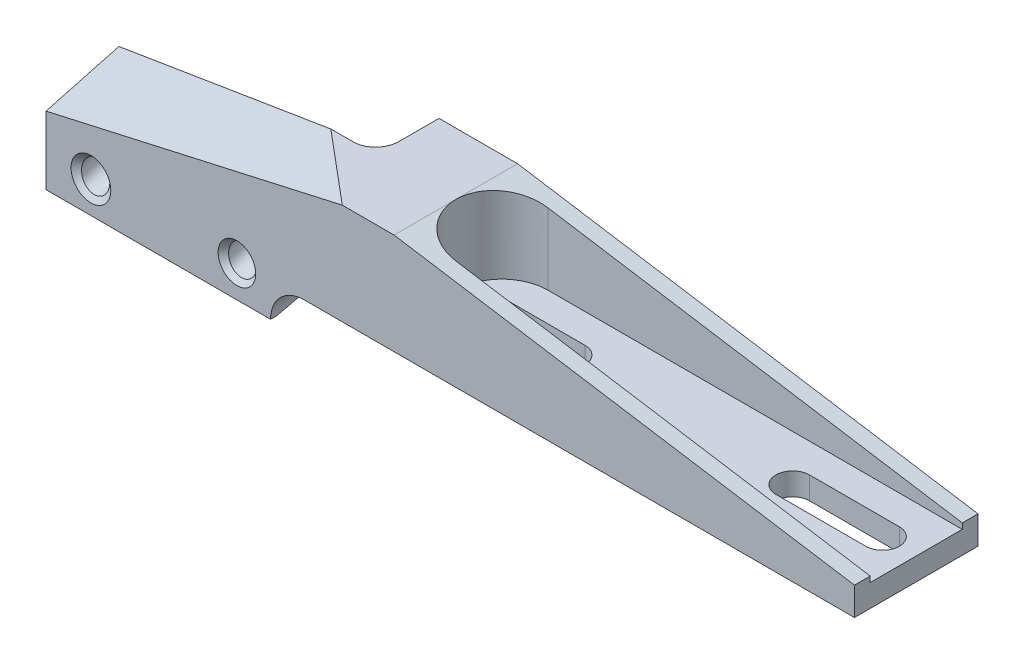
SolidWorks part; units mm, degrees
ref_plane "Front Plane" through (0, 0, 0) normal (0, 0, 1) x (1, 0, 0)
ref_plane "Top Plane" through (0, 0, 0) normal (0, 1, 0) x (1, 0, 0)
ref_plane "Right Plane" through (0, 0, 0) normal (1, 0, 0) x (0, 0, -1)
sketch "Sketch1" plane through (0, 0, 0) normal (0, 0, 1) x (1, 0, 0)
  line L0 (8, 9) -> (-23, 9)
  line L1 (0, 0) -> (49, 0)
  line L2 (-23, 9) -> (-23, -3)
  line L3 (8, 9) -> (49, 2.5)
  line L4 (49, 0) -> (49, 2.5)
  line L5 (-23, -3) -> (-3, -3)
  arc A0 (0, 0) -> (-3, -3) centre (0, -3) ccw
  dimension "D5" = 3
  dimension "D1" = 2.5
  dimension "D2" = 72
  dimension "D3" = 23
  dimension "D4" = 3
  dimension "D6" = 31
  dimension "D7" = 9
extrude "Extrude1" add sketch "Sketch1" along normal blind 18
sketch "Sketch2" plane through (0, 0, 0) normal (0, 1, 0) x (1, 0, 0)
  line L0 (-23, -18) -> (-23, 0) construction
  line L1 (10, -4) -> (18, -4)
  line L2 (10, -4) -> (10, -7) construction
  line L3 (10, -7) -> (18, -7)
  line L4 (18, -4) -> (18, -7) construction
  line L5 (38, -4) -> (46, -4)
  line L6 (38, -4) -> (38, -7) construction
  line L7 (38, -7) -> (46, -7)
  line L8 (46, -4) -> (46, -7) construction
  line L10 (49, -18) -> (-0.75, -18)
  line L11 (49, -18) -> (49, -11)
  line L12 (49, -11) -> (1.5, -11)
  line L13 (-0.75, -18) -> (-0.75, -13.25)
  line L16 (-23, -18) -> (-23, 0) construction
  arc A0 (10, -4) -> (10, -7) centre (10, -5.5) ccw
  arc A1 (18, -7) -> (18, -4) centre (18, -5.5) ccw
  arc A2 (38, -7) -> (38, -4) centre (38, -5.5) cw
  arc A3 (46, -7) -> (46, -4) centre (46, -5.5) ccw
  arc A4 (1.5, -11) -> (-0.75, -13.25) centre (1.5, -13.25) ccw
  dimension "D6" = 2.25
  dimension "D1" = 5.5
  dimension "D2" = 33
  dimension "D3" = 3
  dimension "D4" = 8
  dimension "D5" = 28
  dimension "D7" = 11
  dimension "D8" = 24.5
extrude "Cut-Extrude1" cut sketch "Sketch2" along normal through all and the other way through all
ref_plane "Plane1" through (0, 2, 0) normal (0, 1, 0) x (-1, 0, 0)
sketch "Sketch3" plane through (0, 2, 0) normal (0, 1, 0) x (-1, 0, 0)
  line L0 (-49, 11) -> (-49, 0) construction
  line L1 (-49, 1.4) -> (-12.1, 1.4)
  line L2 (-49, 1.4) -> (-49, 9.6)
  line L3 (-49, 9.6) -> (-12.1, 9.6)
  line L4 (-12.1, 1.4) -> (-12.1, 9.6) construction
  line L5 (-12.1, 5.5) -> (-8, 5.5) construction
  line L6 (23, 18) -> (23, 0) construction
  arc A0 (-12.1, 9.6) -> (-12.1, 1.4) centre (-12.1, 5.5) cw
  dimension "D1" = 8.2
  dimension "D2" = 31
extrude "Cut-Extrude2" cut sketch "Sketch3" along normal through all
sketch "Sketch5" plane through (0, 0, 0) normal (1, 0, 0) x (0, 0, -1)
  line L0 (0, 0) -> (0, -28) construction
  line L1 (0, 0) -> (-11, 0) construction
  line L2 (0, 0) -> (0, 9) construction
  line L3 (0, 9) -> (-11, 9) construction
  line L4 (-11, 0) -> (-11, 9) construction
  line L5 (0, -28) -> (-11, -28) construction
  line L6 (0, -28) -> (0, -37) construction
  line L7 (0, -37) -> (-11, -37) construction
  line L8 (-11, -28) -> (-11, -37) construction
  line L9 (-2.9177, -1.1399) -> (4.1222, -27.413) construction
  line L10 (0, -28) -> (4.161, -28) construction
  line L11 (-0.0588, -0.2185) -> (7.0588, -26.7815) construction
  line L12 (13.2227, 3.3402) -> (-13.3402, -3.7773) construction
  line L13 (20.3402, -23.2227) -> (-6.2227, -30.3402) construction
  line L14 (-2.9177, -1.1399) -> (-2.9565, -0.995) construction
  line L15 (4.1222, -27.413) -> (4.161, -27.5579) construction
  line L16 (-0.0588, -0.2185) -> (-2.5289, 9) construction
  line L17 (7.0588, -26.7815) -> (8.7928, -33.2532) construction
  line L18 (-5.1905, -37) -> (5.8951, -34.0296) construction
  line L19 (-11, 2.5) -> (-11, 0) construction
  line L20 (3.5, -13.5) -> (0.6022, -14.2765) construction
  line L21 (0, -14) -> (3.5, -14) construction
  line L22 (-2.9565, -0.995) -> (-3.2231, 0) construction
  line L23 (-11, -37) -> (-5.1905, -37)
  line L24 (0, 9) -> (-5.8095, 9)
  line L25 (-5.8095, 9) -> (-4.0755, 2.5283) construction
  line L26 (-4.0755, 2.5283) -> (-15.161, -0.4421) construction
  line L27 (-15.161, -0.4421) -> (-16.8951, 6.0296) construction
  line L28 (-16.8951, 6.0296) -> (-5.8095, 9) construction
  line L29 (-4.0755, 2.5283) -> (0, 3.6203) construction
  line L30 (4.161, -27.5579) -> (5.8951, -34.0296) construction
  line L31 (5.8951, -34.0296) -> (8.7928, -33.2532) construction
  line L32 (-3.6683, 1.6613) -> (-22.9868, -3.5151) construction
  line L33 (-22.9868, -3.5151) -> (-14.4458, -35.3906) construction
  line L34 (-14.4458, -35.3906) -> (4.8727, -30.2142) construction
  line L35 (-18.7163, -19.4528) -> (0.6022, -14.2765) construction
  line L36 (4.8727, -30.2142) -> (-5.5, -30.2142) construction
  line L37 (-5.5, -30.2142) -> (-5.5, -28) construction
  line L38 (-11, 0) -> (-11, 2.2142) construction
  line L39 (-11, 2.2142) -> (-15.8727, 2.2142) construction
  circle A0 centre (3.5, -13.5) radius 5 construction
  dimension "D11" = 10
  dimension "D1" = 15
  dimension "D2" = 27.2
  dimension "D3" = 3
  dimension "D4" = 27.5
  dimension "D5" = 28
  dimension "D6" = 6.7
  dimension "D7" = 3.5
  dimension "D8" = 0.5
  dimension "D9" = 0.4421
  dimension "D10" = 2.9565
  dimension "D12" = 33
  dimension "D13" = 20
sketch "Sketch4" plane through (-23, -23, 0) normal (1, 0, 0) x (0, -1, 0)
  line L1 (-22.005, -2.9565) -> (-19.8498, -11)
  line L2 (-19.8498, -11) -> (-32, -11)
  line L3 (-22.005, -2.9565) -> (-22.7972, 0)
  line L4 (-17.8498, 0) -> (-17.8498, -18)
  line L5 (-17.8498, -18) -> (-32, -18)
  line L6 (-32, -18) -> (-32, -11)
  line L7 (-23, -11) -> (-32, -11) construction
  line L8 (-26.3402, 13.2227) -> (-19.2227, -13.3402) construction
  line L9 (-22.7972, 0) -> (-17.8498, 0)
  line L10 (-32, 0) -> (-20, 0) construction
  dimension "D1" = 2
extrude "Cut-Extrude3" cut sketch "Sketch4" along normal blind 26
sketch "Sketch6" plane through (0, -0.1892, -0.0507) normal (0, -0.9659, -0.2588) x (1, 0, 0)
  line L0 (-1, 3.1133) -> (0, 3.1133) construction
  line L1 (-23, -2.3294) -> (1, -2.3294)
  line L2 (-23, -2.3294) -> (-23, 3.1133)
  line L3 (-23, 3.1133) -> (-1, 3.1133)
  line L4 (1, -2.3294) -> (1, 1.1133)
  arc A0 (-1, 3.1133) -> (1, 1.1133) centre (-1, 1.1133) cw
  dimension "D1" = 2
  dimension "D2" = 24
extrude "Cut-Extrude4" cut sketch "Sketch6" against normal through all
sketch "Sketch7" plane through (0, 0, 0) normal (0, 1, 0) x (1, 0, 0)
  line L0 (0, -3.2231) -> (-25, -3.2231) construction
  dimension "D1" = 25
ref_plane "Plane2" through (0, -0.8058, 3.0072) normal (0, 0.2588, -0.9659) x (-1, 0, 0)
sketch "Sketch8" plane through (0, -0.8058, 3.0072) normal (0, 0.2588, -0.9659) x (-1, 0, 0)
  line L0 (0, -13.9459) -> (19, -13.9459) construction
  line L1 (23, 10.1517) -> (23, -0.1959) construction
  line L2 (6, 2.5541) -> (19, 2.5541) construction
  line L3 (6, 2.5541) -> (6, -30.4459) construction
  line L4 (6, -30.4459) -> (19, -30.4459) construction
  line L5 (19, 2.5541) -> (19, -30.4459) construction
  line L6 (23, 11.5403) -> (-3.3882, 11.5403)
  line L7 (23, 11.5403) -> (23, 5.8041)
  line L8 (23, 5.8041) -> (-3.3882, 11.5403)
  line L9 (3, 10.1517) -> (23, 10.1517) construction
  line L10 (1, 10.1517) -> (23, 10.1517) construction
  circle A0 centre (6, 2.5541) radius 1.25
  circle A1 centre (19, 2.5541) radius 1.25
  dimension "D6" = 2.5
  dimension "D1" = 33
  dimension "D2" = 13
  dimension "D3" = 4
  dimension "D4" = 20
  dimension "D5" = 6
extrude "Cut-Extrude5" cut sketch "Sketch8" against normal through all
chamfer "Chamfer1" distance 0.3 angle 45 4 edges at (-19, 2.8687, 3.9918) (-19, 0.9909, 11) (-6, 2.8687, 3.9918) (-6, 0.9909, 11)
sketch "Sketch9" [suppressed] plane through (-23, 0, 0) normal (-1, 0, 0) x (0, 0, 1)
  line L0 (16.8951, 6.0296) -> (15.161, -0.4421)
  line L1 (15.161, -0.4421) -> (0, 3.6203)
  line L2 (0, 3.6203) -> (0, 9) construction
  line L3 (0, 9) -> (5.8095, 9) construction
  line L4 (5.8095, 9) -> (16.8951, 6.0296)
  line L5 (5.8095, 9) -> (18, 9)
  line L6 (18, 9) -> (18, -3)
  line L7 (18, -3) -> (0, -3)
  line L8 (0, -3) -> (0, 3.6203)
extrude "Cut-Extrude6" [suppressed] cut sketch "Sketch9" against normal blind 25
fillet "Fillet1" [suppressed] radius 2
sketch "Sketch10" [suppressed] plane through (0, 3.3778, 0.9051) normal (0, -0.9659, -0.2588) x (1, 0, 0)
  line L0 (-23, 7.7588) -> (-23, -2.3294)
  line L1 (-23, 14.7588) -> (-23, -0.937) construction
  line L2 (-23, 7.7588) -> (7, -2.3294)
  line L3 (7, -2.3294) -> (-23, -2.3294)
  line L4 (8, -2.3294) -> (-23, -2.3294) construction
  dimension "D1" = 7
  dimension "D2" = 30
extrude "Cut-Extrude7" [suppressed] cut sketch "Sketch10" against normal through all and the other way through all
sketch "Sketch11" [suppressed] plane through (0, -0.8058, 3.0072) normal (0, 0.2588, -0.9659) x (-1, 0, 0)
  line L0 (6, 6.247) -> (0, 6.247) construction
  line L1 (6, 6.247) -> (19, 6.247) construction
  line L2 (23, 10.197) -> (23, 3.497) construction
  line L3 (-2, 12.0356) -> (-4.7661, 12.0356)
  line L4 (-49, 5.2618) -> (-8, 11.5403) construction
  line L5 (-2, 12.0356) -> (-2, 10.197)
  circle A0 centre (6, 6.247) radius 1.25
  circle A1 centre (19, 6.247) radius 1.25
  arc A2 (-2, 10.197) -> (-4.7661, 12.0356) centre (-2, 13.197) cw
  dimension "D1" = 2.5
  dimension "D4" = 3
  dimension "D2" = 13
  dimension "D3" = 4
extrude "Cut-Extrude8" [suppressed] cut sketch "Sketch11" against normal through all and the other way through all
chamfer "Chamfer2" [suppressed] distance 0.3 angle 45
